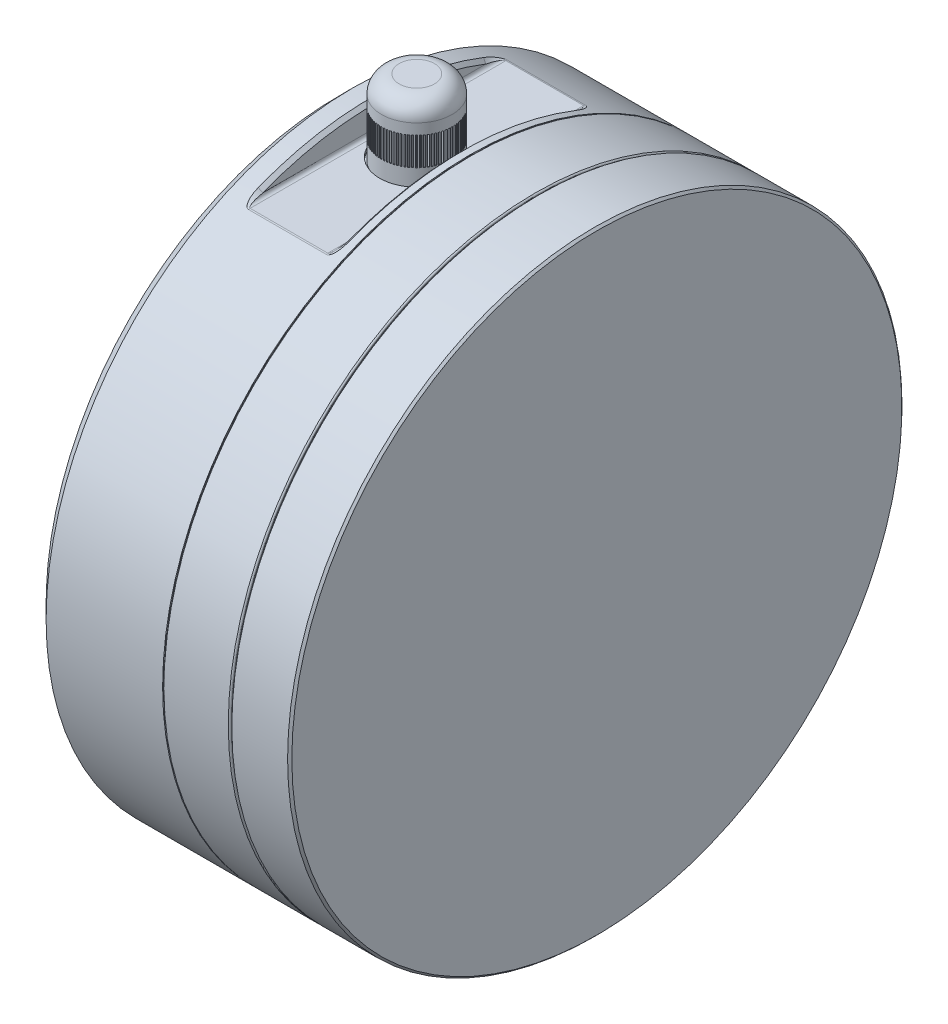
SolidWorks part; units mm, degrees
ref_plane "前视基准面" through (0, 0, 0) normal (0, 0, 1) x (1, 0, 0)
ref_plane "上视基准面" through (0, 0, 0) normal (0, 1, 0) x (1, 0, 0)
ref_plane "右视基准面" through (0, 0, 0) normal (1, 0, 0) x (0, 0, -1)
imported_body "flange1"
imported_body "flange2"
imported_body "flange3"
imported_body "flange4"
sketch "草图1" plane through (37, 0, 0) normal (1, 0, 0) x (0, 0, -1)
  circle A0 centre (0, 0) radius 43
  dimension "D1" = 86
extrude "凸台-拉伸1" add sketch "草图1" against normal up to surface (13.5 mm away)
sketch "草图2" plane through (23.5, 0, 0) normal (-1, 0, 0) x (0, 0, 1)
  arc A6 (7.832, 33.0857) -> (7.925, 33.1516) centre (5.6233, 36.3) ccw
  arc A7 (7.832, 33.0857) -> (-7.832, 33.0857) centre (0, 0) ccw
  arc A8 (-7.925, 33.1516) -> (-7.832, 33.0857) centre (-5.6233, 36.3) ccw
  arc A9 (-7.925, 33.1516) -> (-20.8901, 33.6417) centre (-14.7708, 23.787) ccw
  arc A10 (-20.8901, 33.6417) -> (20.8901, 33.6417) centre (0, 0) ccw
  arc A11 (20.8901, 33.6417) -> (7.925, 33.1516) centre (14.7708, 23.787) ccw
  arc A12 (7.832, 33.0857) -> (7.925, 33.1516) centre (5.6233, 36.3) ccw
  arc A13 (7.832, 33.0857) -> (-7.832, 33.0857) centre (0, 0) ccw
  arc A14 (-7.925, 33.1516) -> (-7.832, 33.0857) centre (-5.6233, 36.3) ccw
  arc A15 (-7.925, 33.1516) -> (-20.8901, 33.6417) centre (-14.7708, 23.787) ccw
  arc A16 (-20.8901, 33.6417) -> (20.8901, 33.6417) centre (0, 0) ccw
  arc A17 (20.8901, 33.6417) -> (7.925, 33.1516) centre (14.7708, 23.787) ccw
  dimension "D1" = 0
sketch "草图3" plane through (23.5, 0, 0) normal (-1, 0, 0) x (0, 0, 1)
  line L0 (-18.1108, 39) -> (18.1108, 39)
  arc A0 (-18.1108, 39) -> (18.1108, 39) centre (0, 0) ccw
  dimension "D1" = 86
  dimension "D2" = 39
extrude "凸台-拉伸3" add sketch "草图3" along normal up to body separate body
sketch "草图4" plane through (43, 0, 0) normal (1, 0, 0) x (0, 0, -1)
  circle A0 centre (0, 0) radius 41.3 construction
  circle A1 centre (0, 0) radius 41.3
extrude "凸台-拉伸4" add sketch "草图4" against normal blind 10
